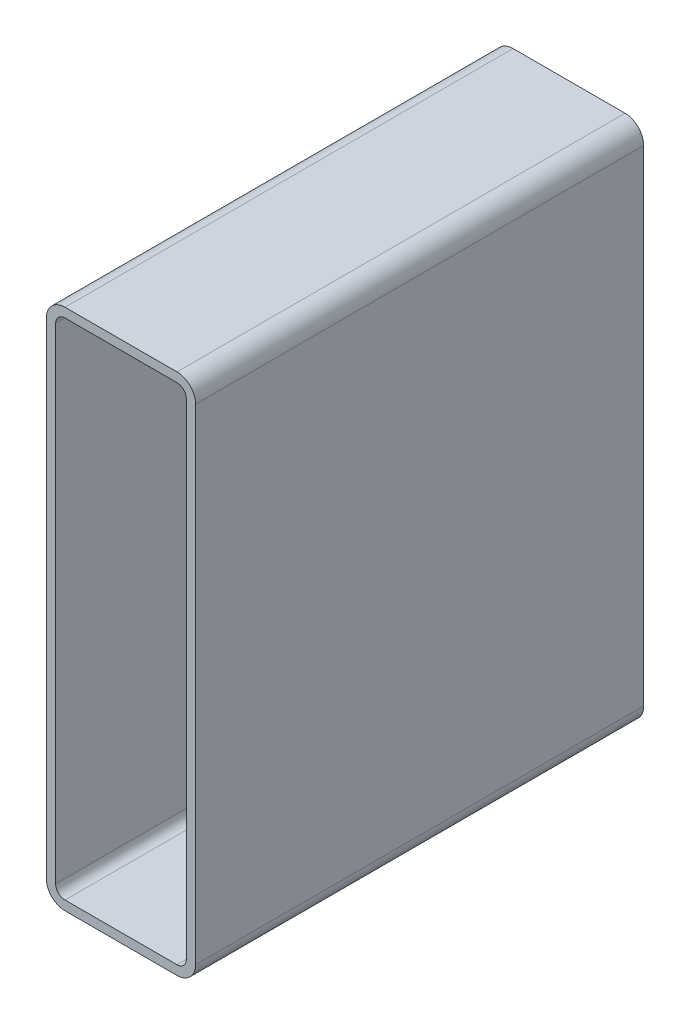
SolidWorks part; units mm, degrees
ref_plane "Front Plane" through (0, 0, 0) normal (0, 0, 1) x (1, 0, 0)
ref_plane "Top Plane" through (0, 0, 0) normal (0, 1, 0) x (1, 0, 0)
ref_plane "Right Plane" through (0, 0, 0) normal (1, 0, 0) x (0, 0, -1)
sketch "Sketch1" plane through (0, 0, 0) normal (0, 0, 1) x (1, 0, 0)
sketch_block_instance "HSS14x4x0.250-1"
sketch_block "HSS14x4x0.250"
extrude "Boss-Extrude1" add sketch "Sketch1" along normal blind 304.8
